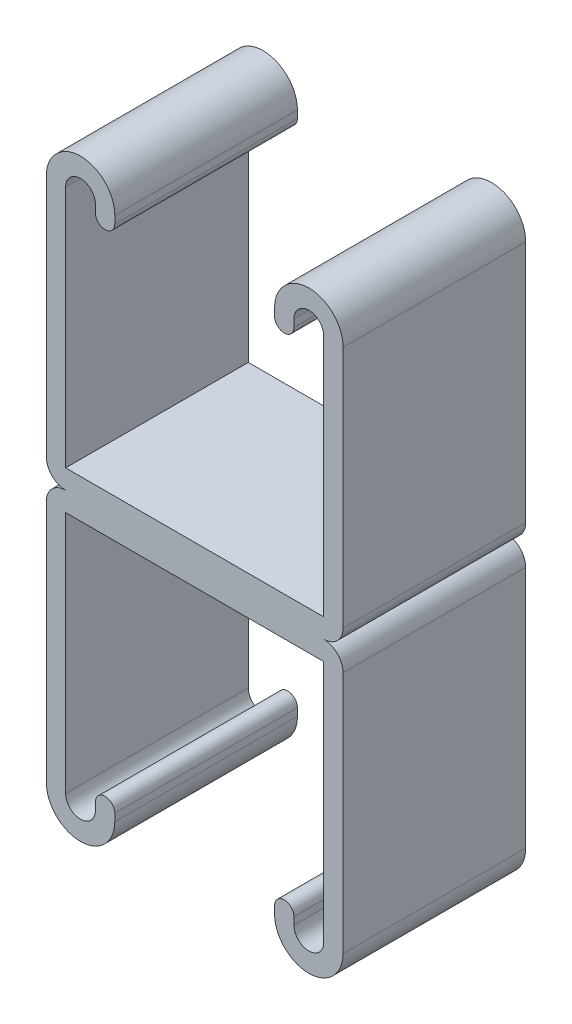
SolidWorks part; units mm, degrees
ref_plane "Plane1" through (0, 0, 0) normal (0, 0, 1) x (1, 0, 0)
ref_plane "Plane2" through (0, 0, 0) normal (0, 1, 0) x (1, 0, 0)
ref_plane "Plane3" through (0, 0, 0) normal (1, 0, 0) x (0, 0, -1)
sketch "Sketch1" plane through (0, 0, 0) normal (0, 0, 1) x (1, 0, 0)
  line L0 (-20.6375, 36.5125) -> (-20.6375, 2.6924)
  line L1 (-17.9451, 0) -> (17.9451, 0)
  line L2 (20.6375, 2.6924) -> (20.6375, 36.5125)
  line L3 (11.1125, 36.5125) -> (11.1125, 35.4774)
  line L4 (-11.1125, 36.5125) -> (-11.1125, 35.4774)
  line L5 (-13.8049, 36.5125) -> (-13.8049, 35.4774)
  line L6 (-17.9451, 36.5125) -> (-17.9451, 2.6924)
  line L7 (-17.9451, 2.6924) -> (17.9451, 2.6924)
  line L8 (17.9451, 2.6924) -> (17.9451, 36.5125)
  line L9 (13.8049, 36.5125) -> (13.8049, 35.4774)
  line L10 (-25.4, 41.275) -> (25.4, 41.275) construction
  line L11 (-12.8524, 34.1313) -> (12.8524, 34.1313) construction
  arc A0 (20.6375, 36.5125) -> (11.1125, 36.5125) centre (15.875, 36.5125) ccw
  arc A1 (-20.6375, 36.5125) -> (-11.1125, 36.5125) centre (-15.875, 36.5125) cw
  arc A2 (-17.9451, 0) -> (-20.6375, 2.6924) centre (-17.9451, 2.6924) cw
  arc A3 (17.9451, 0) -> (20.6375, 2.6924) centre (17.9451, 2.6924) ccw
  arc A4 (-17.9451, 36.5125) -> (-13.8049, 36.5125) centre (-15.875, 36.5125) cw
  arc A5 (17.9451, 36.5125) -> (13.8049, 36.5125) centre (15.875, 36.5125) ccw
  arc A6 (11.1125, 35.4774) -> (13.8049, 35.4774) centre (12.4587, 35.4774) ccw
  arc A7 (-11.1125, 35.4774) -> (-13.8049, 35.4774) centre (-12.4587, 35.4774) cw
  dimension "D1" = 2.6924
  dimension "D3" = 20.6375
  dimension "Width" = 41.275
  dimension "D6" = 9.525
  dimension "D7" = 22.225
  dimension "D8" = 41.275
  dimension "D9" = 7.1437
  dimension "gauge" = 2.6924
extrude "Base-Extrude" add sketch "Sketch1" along normal mid plane 25.4
mirror "Mirror1" about plane through (0, 0, 0) normal (0, 1, 0) of "Base-Extrude"
equation "\"D3@Sketch1\" = \"Width@Sketch1\" / 2"
equation "\"D7@Sketch1\" = \"Width@Sketch1\" - 2 * \"D6@Sketch1\""
equation "\"D1@Sketch1\" = \"gauge@Sketch1\""
